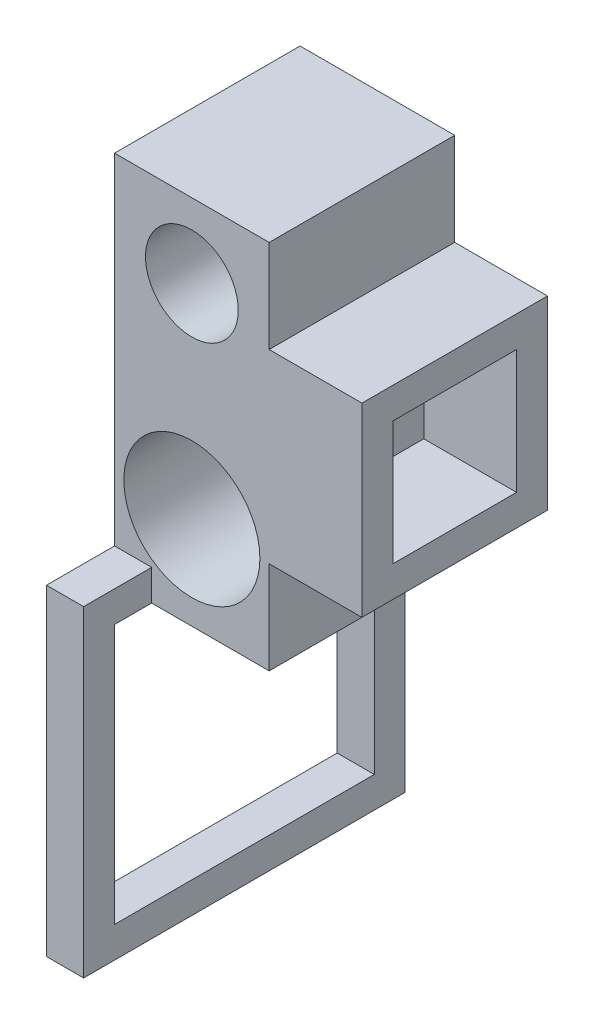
SolidWorks part; units mm, degrees
ref_plane "Alzado" through (0, 0, 0) normal (0, 0, 1) x (1, 0, 0)
ref_plane "Planta" through (0, 0, 0) normal (0, 1, 0) x (1, 0, 0)
ref_plane "Vista lateral" through (0, 0, 0) normal (1, 0, 0) x (0, 0, -1)
sketch "Sketch1" plane through (0, 0, 0) normal (0, 0, 1) x (1, 0, 0)
  line L0 (0, 30) -> (0, 18) construction
  line L1 (-12.5, -30) -> (12.5, -30)
  line L2 (-12.5, -30) -> (-12.5, 30)
  line L3 (-12.5, 30) -> (12.5, 30)
  line L4 (12.5, -30) -> (12.5, 30)
  line L5 (-12.5, -30) -> (12.5, 30) construction
  line L6 (-12.5, 30) -> (12.5, -30) construction
  line L7 (0, 18) -> (0, -15) construction
  line L8 (0, -15) -> (0, -30) construction
  circle A0 centre (0, 18) radius 7.5
  circle A1 centre (0, -15) radius 11
  point P0 (0, 0)
  dimension "D3" = 15
  dimension "D4" = 22
  dimension "D1" = 60
  dimension "D2" = 25
  dimension "D5" = 15
  dimension "D6" = 12
extrude "Boss-Extrude1" add sketch "Sketch1" along normal mid plane 30
sketch "Sketch2" plane through (12.5, 0, 0) normal (1, 0, 0) x (0, 0, -1)
  line L0 (15, -30) -> (15, 30) construction
  line L1 (-10, 10) -> (10, 10)
  line L2 (-10, 10) -> (-10, -10)
  line L3 (-10, -10) -> (10, -10)
  line L4 (10, 10) -> (10, -10)
  line L5 (-10, 10) -> (10, -10) construction
  line L6 (-10, -10) -> (10, 10) construction
  line L7 (-15, 15) -> (15, 15)
  line L8 (-15, 15) -> (-15, -15)
  line L9 (-15, -15) -> (15, -15)
  line L10 (15, 15) -> (15, -15)
  line L11 (-15, 15) -> (15, -15) construction
  line L12 (-15, -15) -> (15, 15) construction
  point P0 (0, 0)
  point P6 (0, 0)
  dimension "D1" = 20
  dimension "D2" = 20
  dimension "D3" = 5
extrude "Boss-Extrude2" add sketch "Sketch2" along normal blind 15
sketch "Sketch6" plane through (-12.5, 0, 0) normal (-1, 0, 0) x (0, 0, 1)
  line L0 (15, -30) -> (-15, -30) construction
  line L1 (-21, -30) -> (21, -30)
  line L2 (-21, -30) -> (-21, -72)
  line L3 (-21, -72) -> (21, -72)
  line L4 (21, -30) -> (21, -72)
  line L5 (-26, -25) -> (-26, -77)
  line L6 (-26, -77) -> (26, -77)
  line L7 (26, -25) -> (26, -77)
  line L8 (-26, -25) -> (26, -25)
  point P6 (0, -30)
  dimension "D1" = 42
  dimension "D2" = 42
  dimension "D3" = 5
extrude "Boss-Extrude4" add sketch "Sketch6" against normal blind 6
